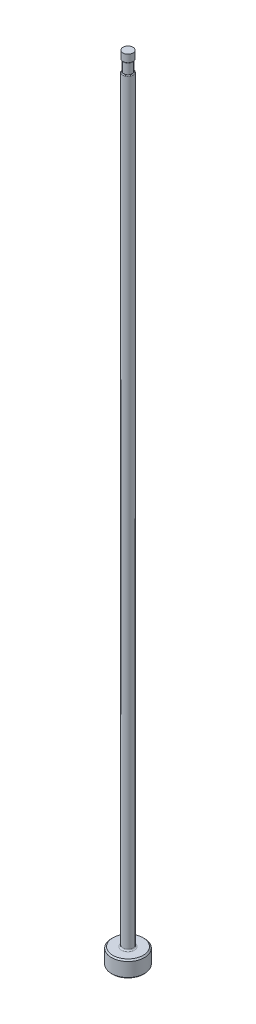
SolidWorks part; units mm, degrees
ref_plane "Front Plane" through (0, 0, 0) normal (0, 0, 1) x (1, 0, 0)
ref_plane "Top Plane" through (0, 0, 0) normal (0, 1, 0) x (1, 0, 0)
ref_plane "Right Plane" through (0, 0, 0) normal (1, 0, 0) x (0, 0, -1)
other "Configuration Table"
sketch "Sketch1" plane through (0, 0, 0) normal (0, 0, 1) x (1, 0, 0)
  line L0 (0, 259.9588) -> (0, -15.1925) construction
  line L1 (0, 0) -> (-3.175, 0)
  line L2 (-3.175, 0) -> (-3.175, 3.175)
  line L3 (-3.175, 3.175) -> (-0.9919, 3.175)
  line L4 (-0.9919, 3.175) -> (-0.9919, 152.4)
  line L5 (-0.9919, 152.4) -> (0, 152.4)
  line L6 (0, 152.4) -> (0, 0)
  dimension "L" = 152.4
  dimension "H" = 6.35
  dimension "T" = 3.175
  dimension "D" = 1.9837
revolve "Revolve1" add sketch "Sketch1" angle 360 about L0
chamfer "Chamfer1" distance 0.254 angle 45 2 edges at (0, 3.175, 3.175) (0, 0, 3.175)
fillet "Fillet1" radius 0.254 1 edges at (0, 3.175, 0.9919)
sketch "Sketch2" plane through (0, 0, 0) normal (0, 0, 1) x (1, 0, 0)
  line L0 (-0.9919, 152.4) -> (-0.9919, 3.429) construction
  line L1 (-0.9919, 150.876) -> (-0.7887, 150.876)
  line L2 (-0.9919, 150.876) -> (-0.9919, 148.844)
  line L3 (-0.9919, 148.844) -> (-0.7887, 148.844)
  line L4 (-0.7887, 150.876) -> (-0.7887, 148.844)
  line L5 (0.9919, 152.4) -> (-0.9919, 152.4) construction
  line L6 (0, 153.4483) -> (0, 147.3282) construction
  dimension "D1" = 2.032
  dimension "N" = 1.524
  dimension "FD" = 0.2032
  dimension "D3" = 1.5773
revolve "Vent Relief" cut sketch "Sketch2" angle 360 about L6
sketch "Sketch3" plane through (0, 0, 0) normal (0, 0, 1) x (1, 0, 0)
  line L0 (-0.7887, 149.86) -> (-0.7887, 86.36)
  line L1 (-0.7887, 150.876) -> (-0.7887, 148.844) construction
  line L2 (-0.9919, 148.844) -> (-0.9919, 3.429) construction
  line L3 (-0.9919, 85.2424) -> (-0.9919, 149.86)
  line L4 (-0.9919, 149.86) -> (-0.7887, 149.86)
  arc A0 (-0.7887, 86.36) -> (-0.9919, 85.2424) centre (-3.9637, 86.36) cw
  dimension "D1" = 3.175
  dimension "D2" = 63.5
extrude "D-Slot" cut sketch "Sketch3" against normal through all both and the other way through all
sketch "Sketch5" plane through (0, 0, 0) normal (0, 0, 1) x (1, 0, 0)
  line L0 (-0.9919, 150.876) -> (0.9919, 150.876) construction
  line L1 (-0.9919, 152.4) -> (-0.9665, 152.4)
  line L2 (-0.9919, 152.4) -> (-0.9919, 150.876)
  line L3 (-0.9919, 150.876) -> (-0.9665, 150.876)
  line L4 (-0.9665, 152.4) -> (-0.9665, 150.876)
  line L5 (0, 152.6877) -> (0, 150.5771) construction
  dimension "VP" = 0.0254
revolve "Vent Diameter" cut sketch "Sketch5" angle 360 about L5
fillet "Fillet2" radius 0.127 2 edges at (0.9919, 148.844, 0) (0, 150.876, 0.9665)
sketch "Pocket Sketch" plane through (0, 0, 0) normal (0, 0, 1) x (1, 0, 0)
  line L0 (-3.5719, 0) -> (-3.5719, 3.2004)
  line L1 (-3.5719, 3.2004) -> (-1.9523, 3.2004)
  line L2 (-1.1903, 3.9624) -> (-1.1903, 22.225)
  line L3 (-1.1903, 22.225) -> (0, 22.225)
  line L4 (0, 22.225) -> (0, 0)
  line L5 (0, 0) -> (-3.5719, 0)
  line L6 (0, 12.6104) -> (0, -2.4989) construction
  line L7 (-3.175, 2.921) -> (-3.175, 0.254) construction
  line L8 (2.921, 3.175) -> (-2.921, 3.175) construction
  line L9 (-0.9919, 85.2424) -> (-0.9919, 3.429) construction
  line L10 (-1.9523, 3.2004) -> (-1.1903, 3.9624)
  point P3 (-1.1903, 3.2004)
  dimension "D1" = 7.1437
  dimension "D2" = 0.3969
  dimension "D3" = 0.0254
  dimension "D4" = 0.1984
  dimension "D5" = 2.3806
  dimension "D6" = 22.225
